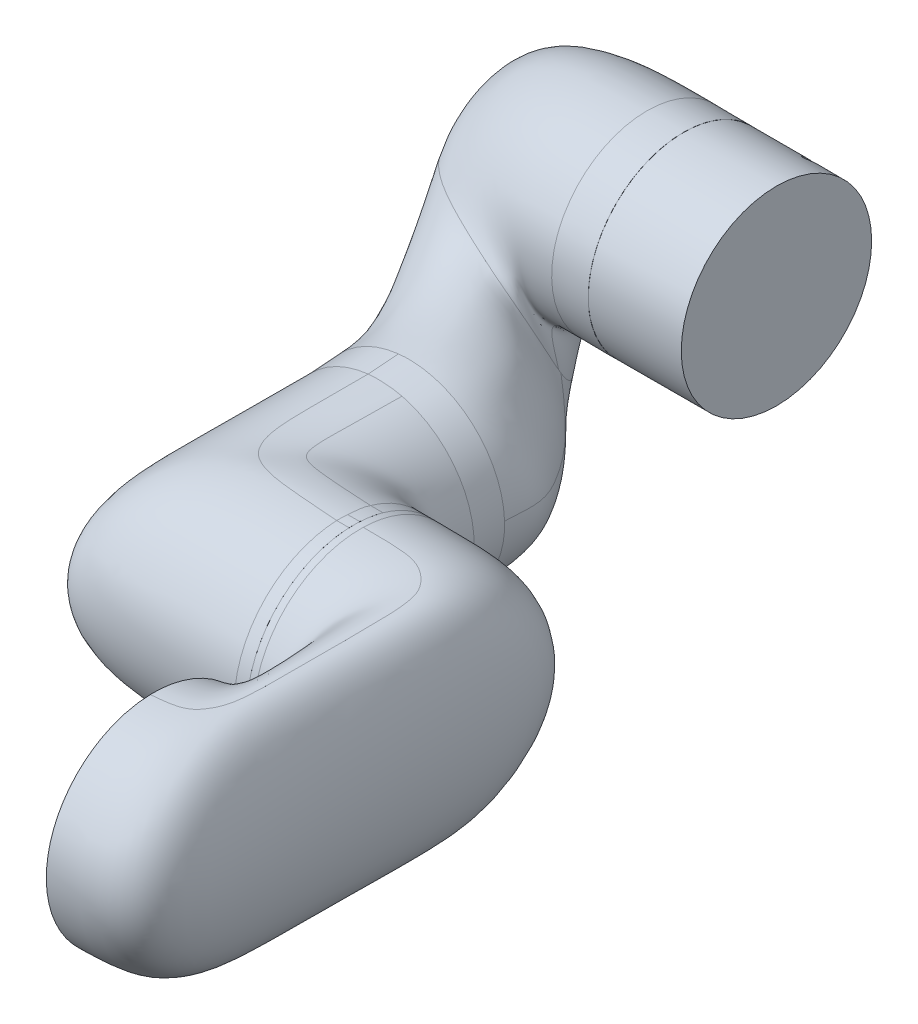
SolidWorks part; units mm, degrees
ref_plane "前视基准面" through (0, 0, 0) normal (0, 0, 1) x (1, 0, 0)
ref_plane "上视基准面" through (0, 0, 0) normal (0, 1, 0) x (1, 0, 0)
ref_plane "右视基准面" through (0, 0, 0) normal (1, 0, 0) x (0, 0, -1)
imported_body "曲面-输入1"
imported_body "输入1"
imported_body "输入2"
imported_body "输入3"
sketch "草图2" plane through (51.3129, 0, 0) normal (-1, 0, 0) x (0, 0, 1)
  circle A0 centre (138.9264, -23.1071) radius 47.4239
  circle A1 centre (138.9264, -23.1071) radius 22.2594
  spline S0 degree 3 number of poles 69 (91.5024, -23.0925) -> (140.2801, 24.2975) construction
  spline S1 degree 3 number of poles 69 (91.5024, -23.0925) -> (140.2801, 24.2975)
  point P7 (0, 0)
  point P8 (138.9264, -23.0925)
extrude "凸台-拉伸1" add sketch "草图2" along normal blind 10 contours A1
